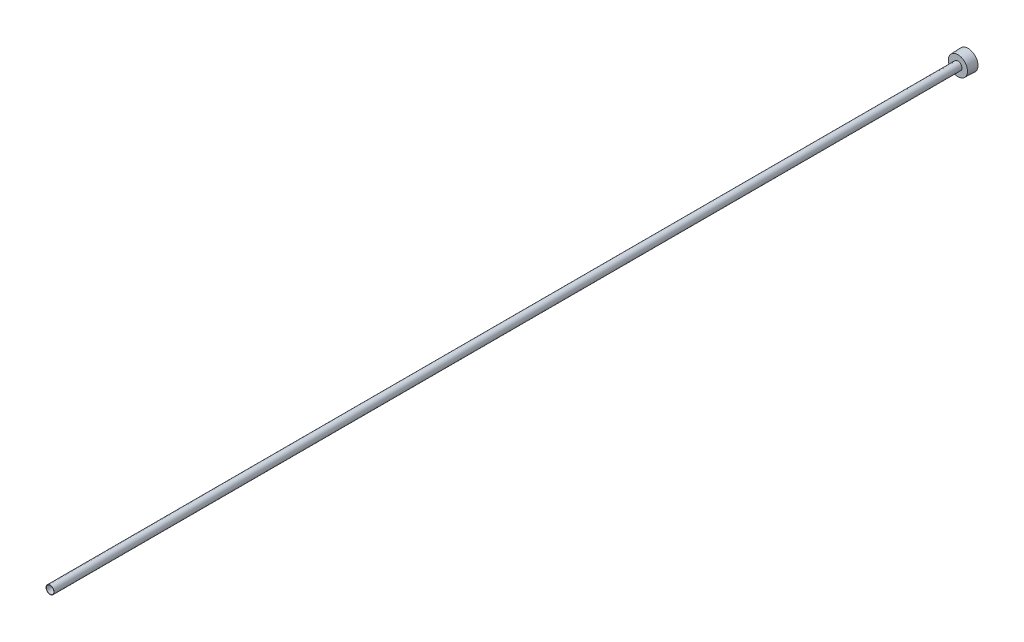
SolidWorks part; units mm, degrees
ref_plane "Front Plane" through (0, 0, 0) normal (0, 0, 1) x (1, 0, 0)
ref_plane "Top Plane" through (0, 0, 0) normal (0, 1, 0) x (1, 0, 0)
ref_plane "Right Plane" through (0, 0, 0) normal (1, 0, 0) x (0, 0, -1)
sketch "Sketch1" plane through (0, 0, 0) normal (1, 0, 0) x (0, 0, -1)
  line L0 (-278.0011, 0) -> (49721.9989, 0) construction
  line L1 (-1219.2, 0) -> (0, 0)
  line L6 (0, 0) -> (0, 13.2207)
  line L7 (0, 13.2207) -> (-13.4874, 12.7287)
  line L8 (-13.4874, 12.7287) -> (-13.4874, 5.4229)
  line L9 (-13.4874, 5.4229) -> (-1219.2, 5.4229)
  line L10 (-1219.2, 5.4229) -> (-1219.2, 0)
  dimension "D1" = 13.4874
  dimension "D2" = 26.4414
  dimension "D3" = 2.089
  dimension "D4" = 10.8458
  dimension "D5" = 1219.2
revolve "Revolve1" add sketch "Sketch1" angle 360 about L0
sketch "Sketch2" plane through (0, 0, 1219.2) normal (0, 0, 1) x (1, 0, 0)
  circle A0 centre (0, 0) radius 5.0419
  dimension "D1" = 10.0838
extrude "Cut-Extrude1" cut sketch "Sketch2" against normal through all
sketch "Sketch3" plane through (0, 0, 0) normal (0, 0, -1) x (-1, 0, 0)
  line L0 (0, 14.5428) -> (0, -14.5428) construction
  line L1 (0, -10.9985) -> (9.525, -5.4993)
  line L2 (9.525, -5.4993) -> (9.525, 5.4993)
  line L3 (9.525, 5.4993) -> (0, 10.9985)
  line L4 (0, 10.9985) -> (-9.525, 5.4993)
  line L5 (-9.525, 5.4993) -> (-9.525, -5.4993)
  line L6 (-9.525, -5.4993) -> (0, -10.9985)
  circle A0 centre (0, 0) radius 9.525 construction
  dimension "D1" = 19.05
extrude "Cut-Extrude2" cut sketch "Sketch3" against normal blind 9.525
